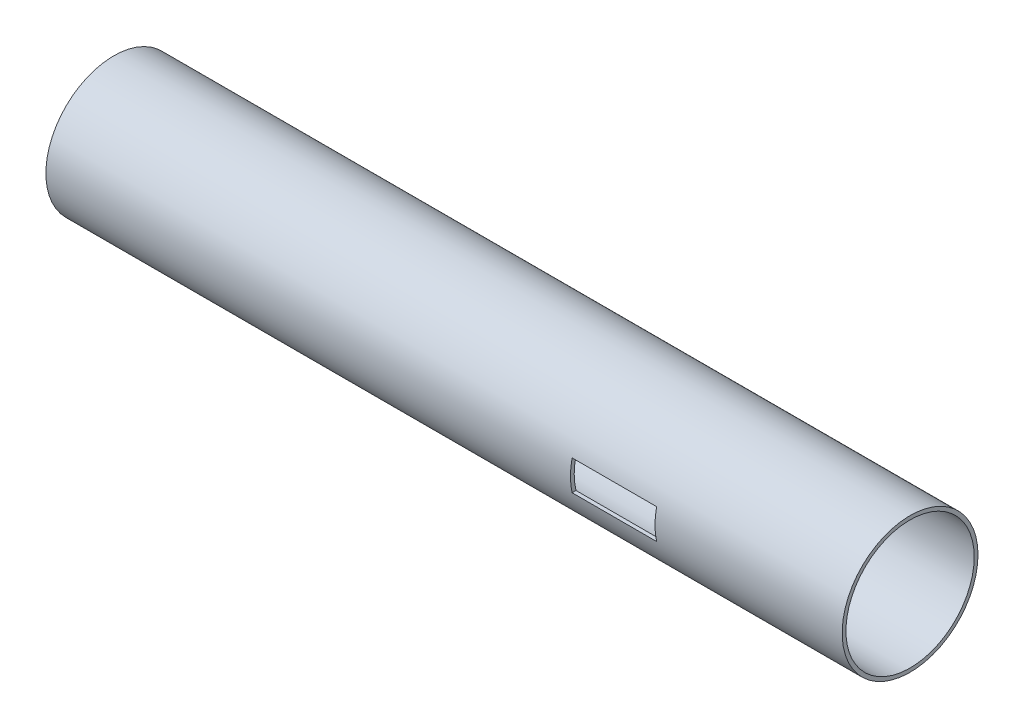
SolidWorks part; units mm, degrees
ref_plane "Front Plane" through (0, 0, 0) normal (0, 0, 1) x (1, 0, 0)
ref_plane "Top Plane" through (0, 0, 0) normal (0, 1, 0) x (1, 0, 0)
ref_plane "Right Plane" through (0, 0, 0) normal (1, 0, 0) x (0, 0, -1)
sketch "Sketch1" plane through (0, 0, 0) normal (1, 0, 0) x (0, 0, -1)
  circle A0 centre (0, 0) radius 28.575
  circle A1 centre (0, 0) radius 26.9875
  dimension "D1" = 57.15
  dimension "D2" = 53.975
extrude "Extrude1" add sketch "Sketch1" along normal blind 334.9625
sketch "Sketch2" plane through (0, 0, 0) normal (0, 0, 1) x (1, 0, 0)
  line L0 (0, 0) -> (334.9625, 0) construction
  line L1 (334.9625, -28.575) -> (334.9625, 28.575) construction
  line L2 (220.6625, -6.35) -> (220.6625, 6.35)
  line L4 (256.2225, 6.35) -> (256.2225, -6.35)
  line L7 (220.6625, 6.35) -> (256.2225, 6.35)
  line L11 (220.6625, -6.35) -> (256.2225, -6.35)
  point P5 (256.2225, 0)
  point P11 (220.6625, 0)
  dimension "D1" = 78.74
  dimension "D2" = 35.56
  dimension "D3" = 12.7
extrude "Cut-Extrude1" cut sketch "Sketch2" along normal through all
